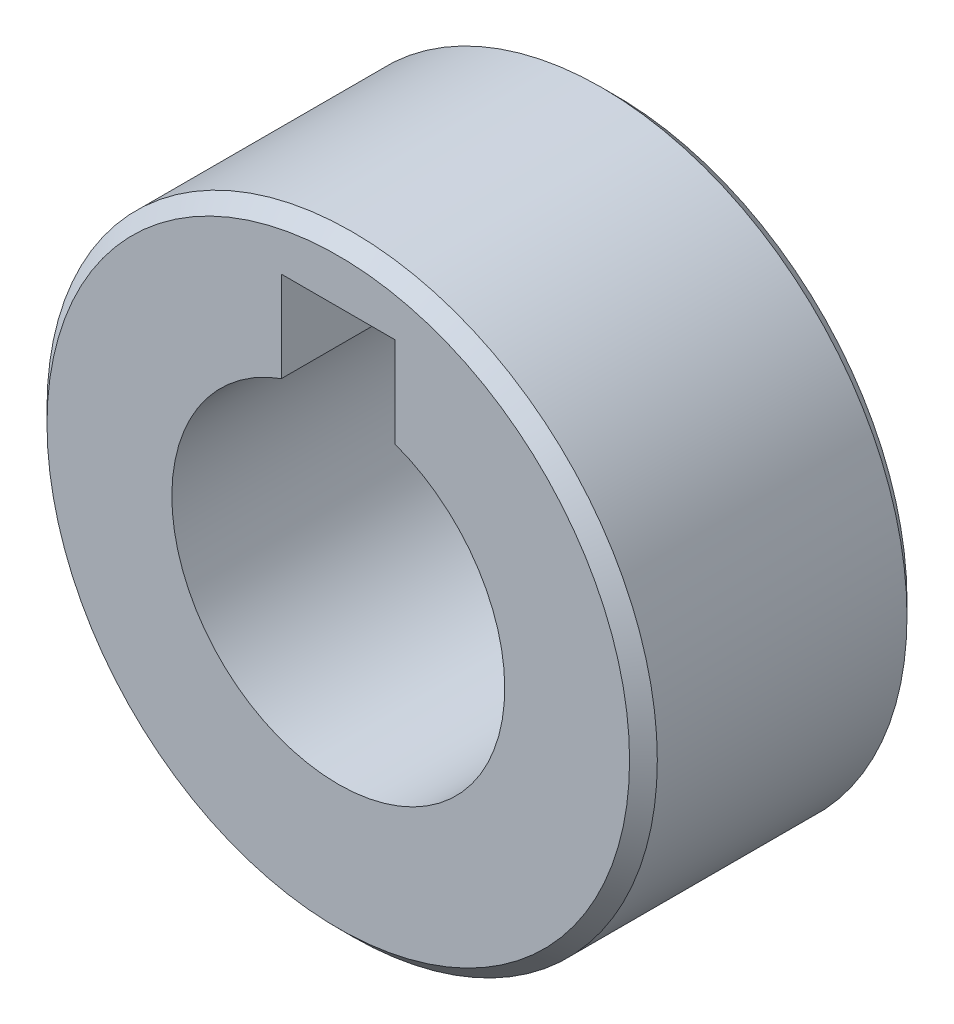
SolidWorks part; units mm, degrees
ref_plane "Face" through (0, 0, 0) normal (0, 0, 1) x (1, 0, 0)
ref_plane "Dessus" through (0, 0, 0) normal (0, 1, 0) x (1, 0, 0)
ref_plane "Droite" through (0, 0, 0) normal (1, 0, 0) x (0, 0, -1)
sketch "Esquisse1" plane through (0, 0, 0) normal (0, 0, 1) x (1, 0, 0)
  circle A0 centre (0, 0) radius 11
  circle A1 centre (0, 0) radius 6
  dimension "D1" = 12
  dimension "D2" = 22
extrude "Extrusion1" add sketch "Esquisse1" along normal blind 10
chamfer "Chanfrein1" distance 0.5 angle 45 2 edges at (11, 0, 0) (11, 0, 10)
sketch "Esquisse2" plane through (0, 0, 10) normal (0, 0, 1) x (1, 0, 0)
  line L0 (0, 0) -> (0, 7.3158) construction
  line L1 (-2.05, 5.6389) -> (-2.05, 8.9)
  line L2 (-2.05, 8.9) -> (2.05, 8.9)
  line L3 (2.05, 5.6389) -> (2.05, 8.9)
  circle A0 centre (0, 0) radius 6 construction
  arc A1 (2.05, 5.6389) -> (-2.05, 5.6389) centre (0, 0) ccw
  point P9 (0, 8.9)
  dimension "D1" = 4.1
  dimension "D2" = 14.9
extrude "Enlèv. mat.-Extru.1" cut sketch "Esquisse2" against normal through all
